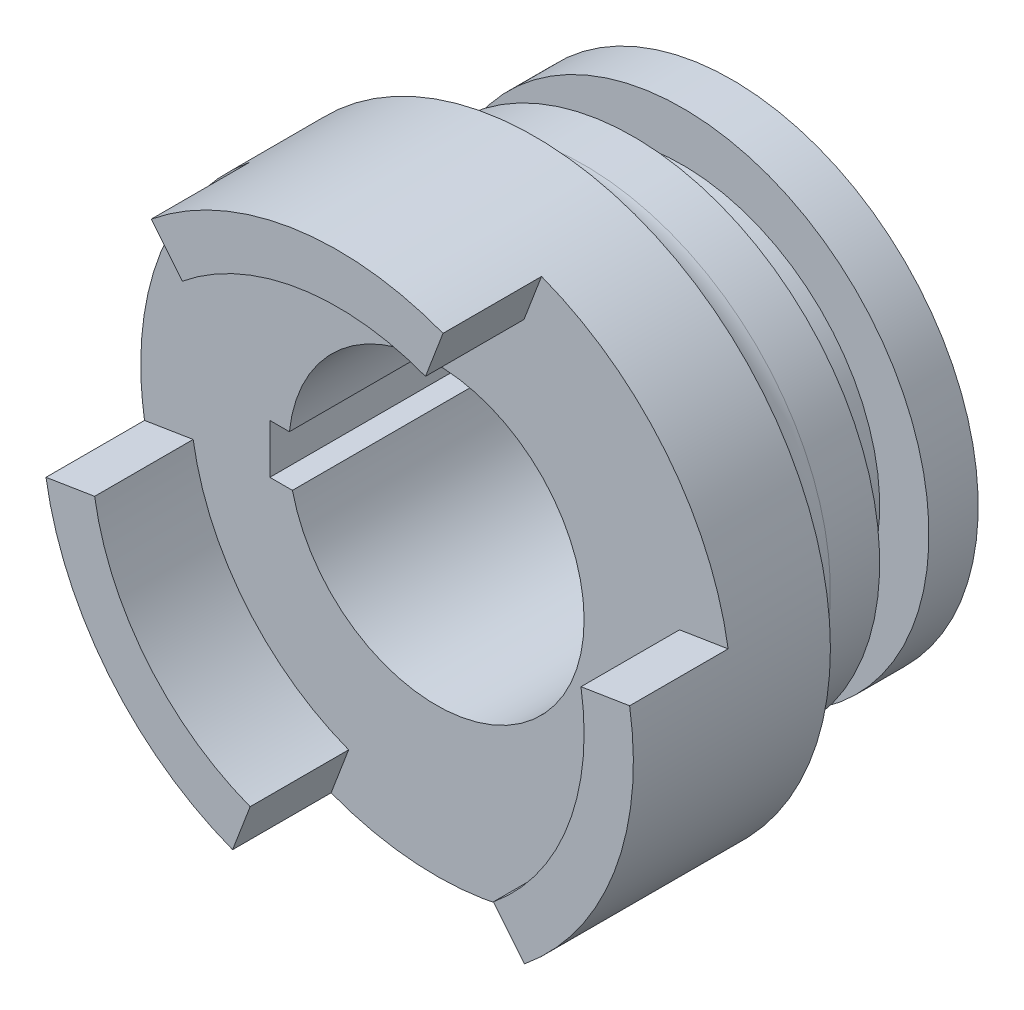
SolidWorks part; units mm, degrees
ref_plane "Front Plane" through (0, 0, 0) normal (0, 0, 1) x (1, 0, 0)
ref_plane "Top Plane" through (0, 0, 0) normal (0, 1, 0) x (1, 0, 0)
ref_plane "Right Plane" through (0, 0, 0) normal (1, 0, 0) x (0, 0, -1)
body saved out of another part "Stock-jaw clutch 1-1"
